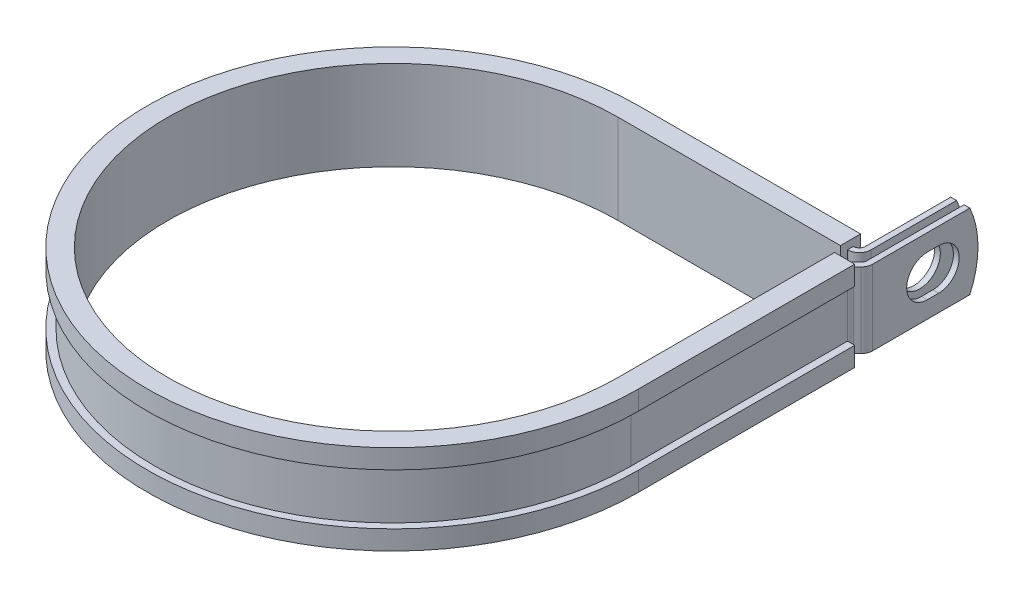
SolidWorks part; units mm, degrees
ref_plane "Front Plane" through (0, 0, 0) normal (0, 0, 1) x (1, 0, 0)
ref_plane "Top Plane" through (0, 0, 0) normal (0, 1, 0) x (1, 0, 0)
ref_plane "Right Plane" through (0, 0, 0) normal (1, 0, 0) x (0, 0, -1)
sketch "Sketch1" plane through (0, 0, 0) normal (0, 1, 0) x (1, 0, 0)
  line L0 (0, 49.149) -> (47.0333, 49.149)
  line L1 (49.149, 0) -> (49.149, 45.7365)
  line L2 (49.4717, 71.4248) -> (49.4717, 51.5874)
  line L3 (49.8632, 47.4607) -> (50.6894, 48.2869)
  line L5 (51.0465, 49.149) -> (51.0465, 71.4248)
  arc A0 (0, 49.149) -> (49.149, 0) centre (0, 0) ccw
  arc A1 (49.8632, 47.4607) -> (49.149, 45.7365) centre (51.5874, 45.7365) ccw
  arc A2 (50.6894, 48.2869) -> (51.0465, 49.149) centre (49.8273, 49.149) ccw
  arc A3 (47.0333, 49.149) -> (49.4717, 51.5874) centre (47.0333, 51.5874) ccw
extrude "Extrude-Thin1" add sketch "Sketch1" along normal mid plane 15.875 thin
sketch "Sketch2" plane through (48.2525, 0, 0) normal (-1, 0, 0) x (0, 0, 1)
  line L0 (-71.4248, 7.9375) -> (-71.4248, -7.9375) construction
  line L1 (0, 7.9375) -> (0, -7.9375) construction
  circle A0 centre (-61.8998, 0) radius 4.3561
  point P2 (-71.4248, 0)
extrude "Cut-Extrude1" cut sketch "Sketch2" against normal up to surface (1.2192 mm away)
sketch "Sketch3" plane through (52.2657, 0, 0) normal (1, 0, 0) x (0, 0, -1)
  line L0 (60.706, 0) -> (63.0936, 0) construction
  line L1 (60.706, 4.3561) -> (63.0936, 4.3561)
  line L2 (60.706, -4.3561) -> (63.0936, -4.3561)
  line L3 (71.4248, 7.9375) -> (71.4248, -7.9375) construction
  arc A0 (60.706, 4.3561) -> (60.706, -4.3561) centre (60.706, 0) ccw
  arc A1 (63.0936, -4.3561) -> (63.0936, 4.3561) centre (63.0936, 0) ccw
  point P3 (61.8998, 0)
  point P8 (71.4248, 0)
  point P11 (56.3499, 0)
  point P12 (67.4497, 0)
extrude "Cut-Extrude2" cut sketch "Sketch3" against normal up to surface (1.2192 mm away)
sketch "Sketch4" plane through (48.2525, 0, 0) normal (-1, 0, 0) x (0, 0, 1)
  line L0 (-71.4248, 7.9375) -> (-71.4248, -7.9375)
  line L1 (-71.4248, 7.9375) -> (-69.6924, 7.9375)
  line L2 (-71.4248, 7.9375) -> (-51.5874, 7.9375) construction
  line L3 (-71.4248, -7.9375) -> (-69.6924, -7.9375)
  line L4 (-71.4248, -7.9375) -> (-51.5874, -7.9375) construction
  arc A0 (-69.6924, 7.9375) -> (-69.6924, -7.9375) centre (-52.3748, 0) ccw
extrude "Cut-Extrude3" cut sketch "Sketch4" against normal through all contours A0 M4 M5 | A0 L0 M2
ref_plane "Plane1" through (0, 0, -45.7365) normal (0, 0, -1) x (-1, 0, 0)
ref_plane "Plane2" through (46.9825, 0, 0) normal (-1, 0, 0) x (0, 0, 1)
sketch "Sketch5" plane through (0, 0, -45.7365) normal (0, 0, -1) x (-1, 0, 0)
  line L0 (-50.3682, 7.9375) -> (-49.149, 7.9375)
  line L1 (-50.3682, 7.9375) -> (-50.3682, -7.9375) construction
  line L3 (-49.149, 7.9375) -> (-49.149, -7.9375)
  line L4 (-49.149, -7.9375) -> (-50.3682, -7.9375)
  line L5 (-50.3682, -7.9375) -> (-50.3682, -5.3975)
  line L6 (-50.3682, 7.9375) -> (-50.3682, 5.3975)
  line L7 (-51.8922, 9.4615) -> (-51.8922, 5.3975)
  line L8 (-51.8922, 9.4615) -> (-47.625, 9.4615)
  line L9 (-47.625, 9.4615) -> (-47.625, -9.4615)
  line L10 (-47.625, -9.4615) -> (-51.8922, -9.4615)
  line L11 (-51.8922, -9.4615) -> (-51.8922, -5.3975)
  line L12 (-51.8922, 5.3975) -> (-50.3682, 5.3975)
  line L13 (-50.3682, -5.3975) -> (-51.8922, -5.3975)
sketch "Sketch6" plane through (0, 7.9375, 0) normal (0, 1, 0) x (1, 0, 0)
  line L0 (47.625, 0) -> (47.625, 45.7365)
  line L1 (47.625, 45.7365) -> (51.8922, 45.7365) construction
  line L2 (46.9825, 6.9878) -> (46.9825, -6.9878) construction
  line L5 (0, 47.625) -> (46.9825, 47.625)
  arc A0 (0, 47.625) -> (47.625, 0) centre (0, 0) ccw
sweep "Sweep1" add profiles "Sketch5" path "Sketch6"
equation "\"D4@Sketch5\" = \"D1@Extrude-Thin1\""
equation "\"D5@Sketch5\" = \"D5@Extrude-Thin1\""
equation "\"D1@Sketch3\" = \"D2@Sketch2\""
equation "\"D7@Sketch1\" = \"D3@Sketch2\" + \"D1@Sketch3\""
equation "\"D1@Sketch1\" = \"D1@Sketch6\" + 2 * \"D3@Sketch5\""
equation "\"D1@Sketch4\" = ( \"D1@Extrude-Thin1\" + .125 ) * 2"
equation "\"D9@Sketch1\"= \"D5@Extrude-Thin1\""
equation "\"D8@Sketch1\"= 2 * \"D5@Extrude-Thin1\""
equation "\"D2@Sketch1\" = 2 * \"D5@Extrude-Thin1\""
equation "\"D2@Sketch3\" = \"D1@Sketch2\""
